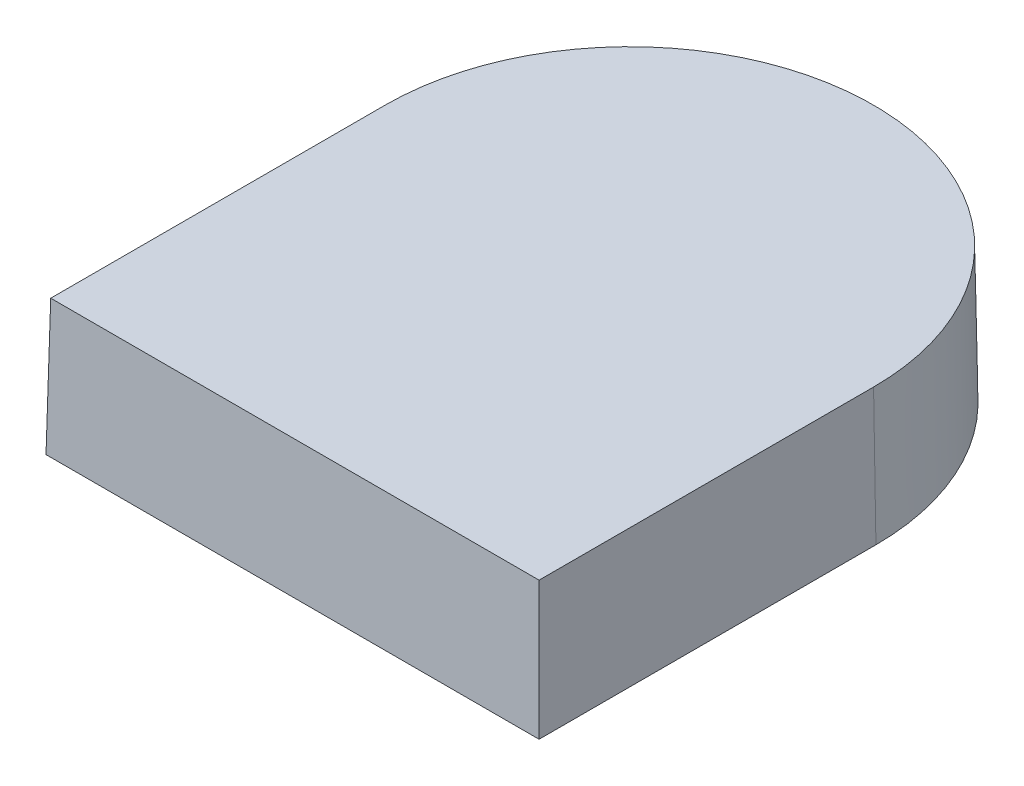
SolidWorks part; units mm, degrees
ref_plane "Płaszczyzna przednia" through (0, 0, 0) normal (0, 0, 1) x (1, 0, 0)
ref_plane "Płaszczyzna górna" through (0, 0, 0) normal (0, 1, 0) x (1, 0, 0)
ref_plane "Płaszczyzna prawa" through (0, 0, 0) normal (1, 0, 0) x (0, 0, -1)
sketch "Szkic2" plane through (0, 0, 0) normal (0, 1, 0) x (1, 0, 0)
  line L0 (13.65, 2.15) -> (13.65, -16.5)
  line L1 (13.65, -16.5) -> (-13.65, -16.5)
  line L2 (-13.65, -16.5) -> (-13.65, 2.15)
  arc A0 (-13.65, 2.15) -> (13.65, 2.15) centre (0, 2.15) cw
  circle A1 centre (0, 0) radius 4.1245 construction
  dimension "D1" = 13.65
  dimension "D5" = 16.5
  dimension "D2" = 27.3
  dimension "D3" = 90
extrude "Dodanie-wyciągnięcie1" add sketch "Szkic2" along normal blind 7.5 draft 1
